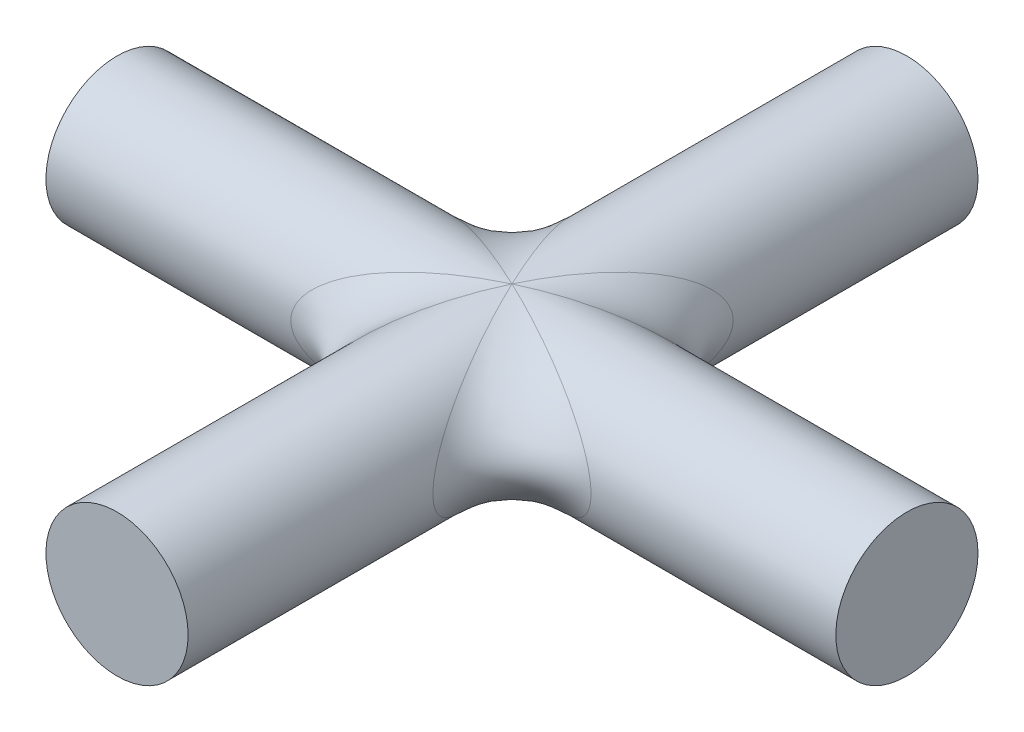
SolidWorks part; units mm, degrees
ref_plane "Front XY" through (0, 0, 0) normal (0, 0, 1) x (1, 0, 0)
ref_plane "Top XZ" through (0, 0, 0) normal (0, 1, 0) x (1, 0, 0)
ref_plane "Right YZ" through (0, 0, 0) normal (1, 0, 0) x (0, 0, -1)
sketch "Sketch1" plane through (0, 0, 0) normal (1, 0, 0) x (0, 0, -1)
  circle A0 centre (0, 0) radius 2.286
  dimension "D1" = 4.572
extrude "Extrude1" add sketch "Sketch1" along normal mid plane 25.4
sketch "Sketch2" plane through (0, 0, 0) normal (0, 0, 1) x (1, 0, 0)
  circle A0 centre (0, 0) radius 2.286
  dimension "D1" = 4.572
extrude "Extrude2" add sketch "Sketch2" along normal mid plane 25.4
fillet "Fillet1" radius 2.54 4 edges at (-2.286, 0, -2.286) (2.286, 0, 2.286) (2.286, 0, -2.286) (-2.286, 0, 2.286)
